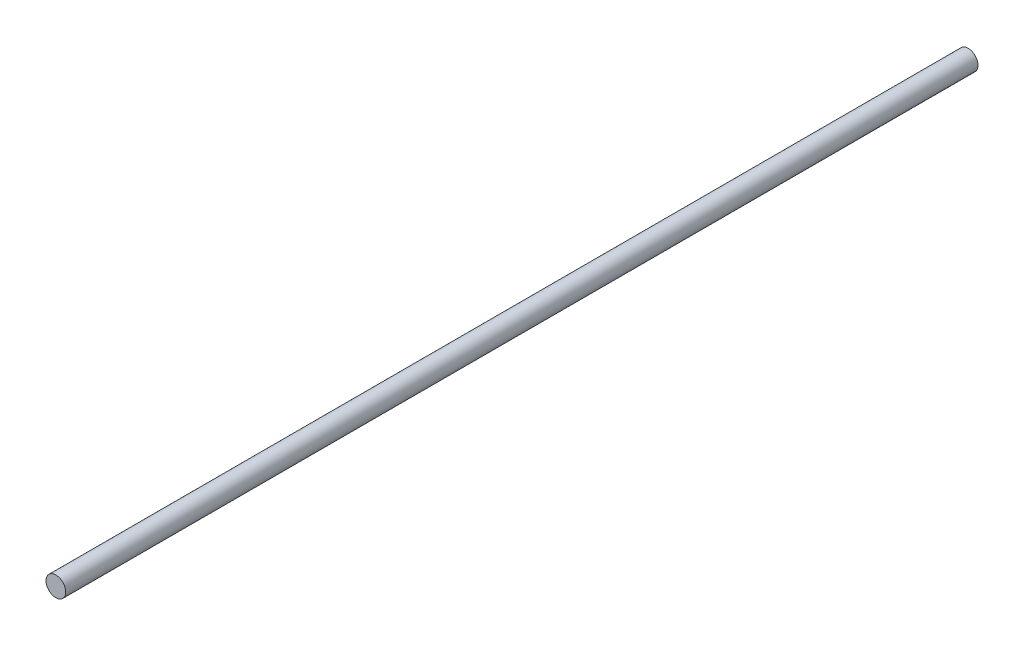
SolidWorks part; units mm, degrees
ref_plane "Front Plane" through (0, 0, 0) normal (0, 0, 1) x (1, 0, 0)
ref_plane "Top Plane" through (0, 0, 0) normal (0, 1, 0) x (1, 0, 0)
ref_plane "Right Plane" through (0, 0, 0) normal (1, 0, 0) x (0, 0, -1)
sketch "Sketch1" plane through (0, 0, 0) normal (0, 0, 1) x (1, 0, 0)
  circle A0 centre (22.7704, 199.9022) radius 4
extrude "Boss-Extrude1" add sketch "Sketch1" along normal blind 370
